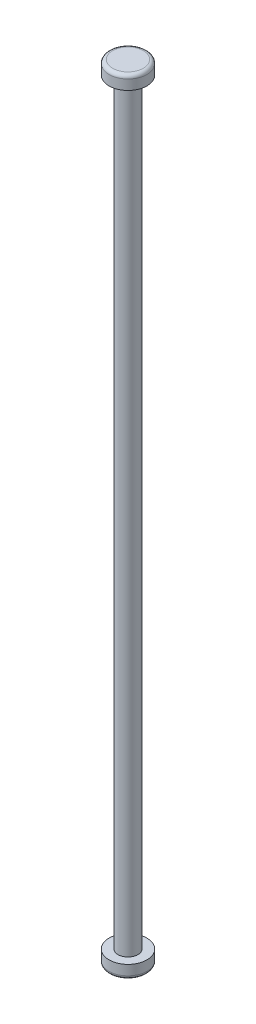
SolidWorks part; units mm, degrees
ref_plane "Front Plane" through (0, 0, 0) normal (0, 0, 1) x (1, 0, 0)
ref_plane "Top Plane" through (0, 0, 0) normal (0, 1, 0) x (1, 0, 0)
ref_plane "Right Plane" through (0, 0, 0) normal (1, 0, 0) x (0, 0, -1)
sketch "Sketch18" plane through (0, 0, 0) normal (0, 1, 0) x (1, 0, 0)
  circle A0 centre (0, 0) radius 0.55
  dimension "D1" = 1.1
extrude "Boss-Extrude1" add sketch "Sketch18" along normal mid plane 42
sketch "Sketch19" plane through (0, 21, 0) normal (0, 1, 0) x (1, 0, 0)
  circle A0 centre (0, 0) radius 1.05
  circle A1 centre (0, 0) radius 0.55 construction
  dimension "D1" = 0.5
extrude "Boss-Extrude2" add sketch "Sketch19" along normal blind 0.75
mirror "Mirror1" about plane through (0, 0, 0) normal (0, 1, 0) of "Boss-Extrude2"
fillet "Fillet2" radius 0.2 1 edges at (0, 21.75, 1.05)
fillet "Fillet3" radius 0.2 1 edges at (0, -21.75, 1.05)
scale "Scale1" scale about centroid uniform scaling yes scale factor 0.7
